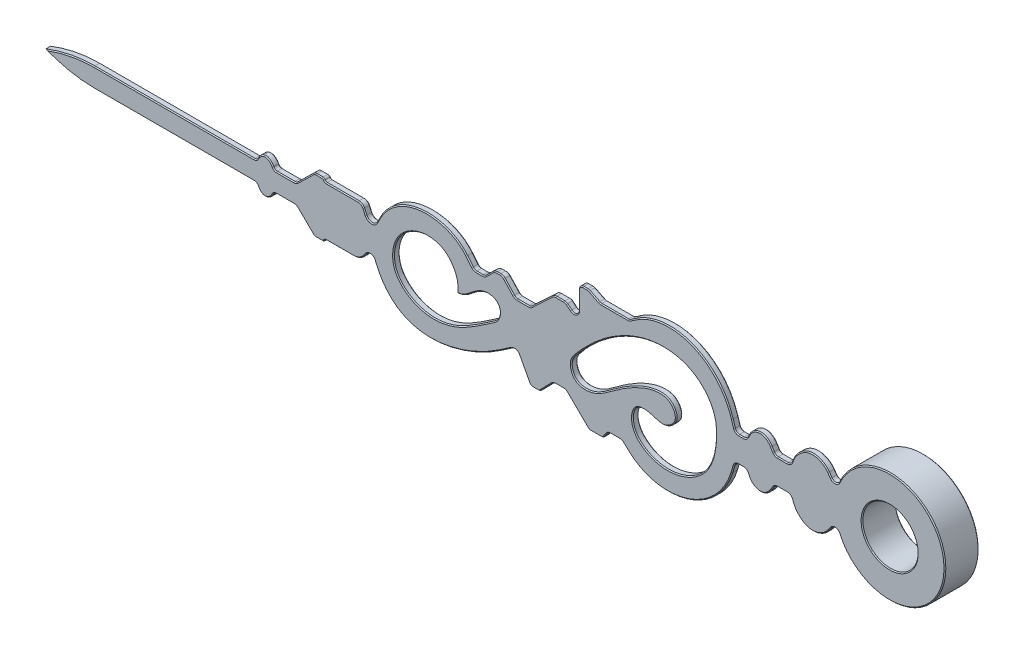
SolidWorks part; units mm, degrees
ref_plane "Спереди" through (0, 0, 0) normal (0, 0, 1) x (1, 0, 0)
ref_plane "Сверху" through (0, 0, 0) normal (0, 1, 0) x (1, 0, 0)
ref_plane "Справа" through (0, 0, 0) normal (1, 0, 0) x (0, 0, -1)
sketch "Эскиз1" plane through (0, 0, 0) normal (0, 0, 1) x (1, 0, 0)
  line L0 (-0.194, -1.2877) -> (0.0882, -1.076)
  line L1 (0.0882, -1.076) -> (0.2999, -0.7585)
  line L2 (0.2999, -0.7585) -> (0.441, -0.4057)
  line L3 (0.441, -0.4057) -> (0.5116, -0.1235)
  line L4 (0.5116, -0.1235) -> (0.4763, 0.194)
  line L5 (0.4763, 0.194) -> (0.3352, 0.5468)
  line L6 (0.3352, 0.5468) -> (0.0882, 0.7584)
  line L7 (0.0882, 0.7584) -> (-0.3351, 0.9701)
  line L8 (-0.3351, 0.9701) -> (-0.7584, 1.0407)
  line L9 (-0.7584, 1.0407) -> (-1.1465, 0.9701)
  line L10 (-1.1465, 0.9701) -> (-1.464, 0.8643)
  line L11 (-1.464, 0.8643) -> (-2.0284, 0.5468)
  line L12 (-2.0284, 0.5468) -> (-2.4871, 0.194)
  line L13 (-2.4871, 0.194) -> (-3.0515, -0.2293)
  line L14 (-3.0515, -0.2293) -> (-3.5454, -0.5116)
  line L15 (-3.5454, -0.5116) -> (-4.1098, -0.5821)
  line L16 (-4.1098, -0.5821) -> (-4.1098, 0.1587)
  line L17 (-4.1098, 0.1587) -> (-4.2862, 0.9348)
  line L18 (-4.2862, 0.9348) -> (-4.6037, 1.6757)
  line L19 (-4.6037, 1.6757) -> (-5.0976, 2.3107)
  line L20 (-5.0976, 2.3107) -> (-5.5209, 2.6634)
  line L21 (-5.5209, 2.6634) -> (-6.0148, 2.9457)
  line L22 (-6.0148, 2.9457) -> (-6.544, 3.0868)
  line L23 (-6.544, 3.0868) -> (-7.3554, 3.1573)
  line L24 (-7.3554, 3.1573) -> (-8.1668, 3.0515)
  line L25 (-8.1668, 3.0515) -> (-8.9429, 2.7693)
  line L26 (-8.9429, 2.7693) -> (-9.6132, 2.3459)
  line L27 (-9.6132, 2.3459) -> (-10.1776, 1.7815)
  line L28 (-10.1776, 1.7815) -> (-10.6362, 1.0759)
  line L29 (-10.6362, 1.0759) -> (-10.8832, 0.3351)
  line L30 (-10.8832, 0.3351) -> (-10.989, -0.5116)
  line L31 (-10.989, -0.5116) -> (-10.9184, -1.1113)
  line L32 (-10.9184, -1.1113) -> (-10.7773, -1.711)
  line L33 (-10.7773, -1.711) -> (-10.4951, -2.2402)
  line L34 (-10.4951, -2.2402) -> (-9.8954, -2.9457)
  line L35 (-9.8954, -2.9457) -> (-9.1898, -3.4749)
  line L36 (-9.1898, -3.4749) -> (-8.3784, -3.863)
  line L37 (-8.3784, -3.863) -> (-7.5318, -4.0746)
  line L38 (-7.5318, -4.0746) -> (-6.6851, -4.1804)
  line L39 (-6.6851, -4.1804) -> (-5.8384, -4.1452)
  line L40 (-5.8384, -4.1452) -> (-4.7448, -3.8982)
  line L41 (-4.7448, -3.8982) -> (-3.7218, -3.5102)
  line L42 (-3.7218, -3.5102) -> (-2.7693, -2.981)
  line L43 (-2.7693, -2.981) -> (-1.8521, -2.4166)
  line L44 (-1.8521, -2.4166) -> (-1.0054, -1.8521)
  line L45 (-1.0054, -1.8521) -> (-0.194, -1.2877)
  line L46 (23.9713, -0.0177) -> (23.936, 0.8643)
  line L47 (23.936, 0.8643) -> (23.7949, 1.7462)
  line L48 (23.7949, 1.7462) -> (23.5127, 2.5929)
  line L49 (23.5127, 2.5929) -> (23.0188, 3.369)
  line L50 (23.0188, 3.369) -> (22.3838, 4.0393)
  line L51 (22.3838, 4.0393) -> (21.6782, 4.5684)
  line L52 (21.6782, 4.5684) -> (20.761, 5.027)
  line L53 (20.761, 5.027) -> (19.8085, 5.3093)
  line L54 (19.8085, 5.3093) -> (18.8207, 5.4857)
  line L55 (18.8207, 5.4857) -> (17.8329, 5.4857)
  line L56 (17.8329, 5.4857) -> (16.5277, 5.3093)
  line L57 (16.5277, 5.3093) -> (15.2929, 4.9565)
  line L58 (15.2929, 4.9565) -> (14.0935, 4.4626)
  line L59 (14.0935, 4.4626) -> (12.8588, 3.7218)
  line L60 (12.8588, 3.7218) -> (11.6946, 2.9104)
  line L61 (11.6946, 2.9104) -> (10.601, 1.9579)
  line L62 (10.601, 1.9579) -> (9.2957, 0.6173)
  line L63 (9.2957, 0.6173) -> (9.0488, 0.3351)
  line L64 (9.0488, 0.3351) -> (8.8371, 0.0882)
  line L65 (8.8371, 0.0882) -> (8.5902, -0.2293)
  line L66 (8.5902, -0.2293) -> (8.3432, -0.7232)
  line L67 (8.3432, -0.7232) -> (8.2727, -1.1113)
  line L68 (8.2727, -1.1113) -> (8.3432, -1.5346)
  line L69 (8.3432, -1.5346) -> (8.4843, -1.9227)
  line L70 (8.4843, -1.9227) -> (8.7666, -2.2402)
  line L71 (8.7666, -2.2402) -> (9.1193, -2.4518)
  line L72 (9.1193, -2.4518) -> (9.5074, -2.5577)
  line L73 (9.5074, -2.5577) -> (10.1424, -2.593)
  line L74 (10.1424, -2.593) -> (10.7068, -2.4518)
  line L75 (10.7068, -2.4518) -> (11.1654, -2.2754)
  line L76 (11.1654, -2.2754) -> (11.5888, -2.0285)
  line L77 (11.5888, -2.0285) -> (11.9768, -1.7816)
  line L78 (11.9768, -1.7816) -> (12.3649, -1.4993)
  line L79 (12.3649, -1.4993) -> (13.2468, -0.8996)
  line L80 (13.2468, -0.8996) -> (14.0935, -0.2999)
  line L81 (14.0935, -0.2999) -> (14.9754, 0.2293)
  line L82 (14.9754, 0.2293) -> (15.9279, 0.6526)
  line L83 (15.9279, 0.6526) -> (16.951, 0.9701)
  line L84 (16.951, 0.9701) -> (17.7271, 1.1112)
  line L85 (17.7271, 1.1112) -> (18.4327, 1.0759)
  line L86 (18.4327, 1.0759) -> (18.8207, 0.9348)
  line L87 (18.8207, 0.9348) -> (19.1382, 0.6879)
  line L88 (19.1382, 0.6879) -> (19.4204, 0.3704)
  line L89 (19.4204, 0.3704) -> (19.5968, -0.1235)
  line L90 (19.5968, -0.1235) -> (19.6674, -0.6174)
  line L91 (19.6674, -0.6174) -> (19.5968, -1.0407)
  line L92 (19.5968, -1.0407) -> (19.3146, -1.3582)
  line L93 (19.3146, -1.3582) -> (18.8913, -1.6404)
  line L94 (18.8913, -1.6404) -> (18.3621, -1.7816)
  line L95 (18.3621, -1.7816) -> (18.0093, -1.8168)
  line L96 (18.0093, -1.8168) -> (17.6918, -1.7463)
  line L97 (17.6918, -1.7463) -> (17.3743, -1.6404)
  line L98 (17.3743, -1.6404) -> (17.0568, -1.5346)
  line L99 (17.0568, -1.5346) -> (16.6688, -1.4288)
  line L100 (16.6688, -1.4288) -> (16.2454, -1.3935)
  line L101 (16.2454, -1.3935) -> (15.8221, -1.4641)
  line L102 (15.8221, -1.4641) -> (15.3988, -1.6052)
  line L103 (15.3988, -1.6052) -> (15.046, -1.958)
  line L104 (15.046, -1.958) -> (14.9049, -2.4166)
  line L105 (14.9049, -2.4166) -> (14.8696, -2.8399)
  line L106 (14.8696, -2.8399) -> (14.9754, -3.2632)
  line L107 (14.9754, -3.2632) -> (15.2224, -3.8277)
  line L108 (15.2224, -3.8277) -> (15.5399, -4.3568)
  line L109 (15.5399, -4.3568) -> (15.9985, -4.8154)
  line L110 (15.9985, -4.8154) -> (16.5277, -5.1682)
  line L111 (16.5277, -5.1682) -> (17.0921, -5.4152)
  line L112 (17.0921, -5.4152) -> (17.6566, -5.5916)
  line L113 (17.6566, -5.5916) -> (18.2563, -5.6974)
  line L114 (18.2563, -5.6974) -> (19.2793, -5.6974)
  line L115 (19.2793, -5.6974) -> (20.3024, -5.521)
  line L116 (20.3024, -5.521) -> (21.2549, -5.133)
  line L117 (21.2549, -5.133) -> (22.1016, -4.5332)
  line L118 (22.1016, -4.5332) -> (22.8071, -3.8277)
  line L119 (22.8071, -3.8277) -> (23.3363, -2.9457)
  line L120 (23.3363, -2.9457) -> (23.6891, -2.0285)
  line L121 (23.6891, -2.0285) -> (23.9007, -1.0407)
  line L122 (23.9007, -1.0407) -> (23.9713, -0.0177)
  line L123 (10.0366, -6.1207) -> (10.0718, -6.156)
  line L124 (10.0718, -6.156) -> (10.1424, -6.1913)
  line L125 (10.1424, -6.1913) -> (10.1777, -6.2266)
  line L126 (10.1777, -6.2266) -> (10.2129, -6.2266)
  line L127 (10.2129, -6.2266) -> (10.2482, -6.2618)
  line L128 (10.2482, -6.2618) -> (10.3188, -6.2618)
  line L129 (10.3188, -6.2618) -> (10.3541, -6.2618)
  line L130 (10.3541, -6.2618) -> (10.3893, -6.2971)
  line L131 (7.8141, -3.9335) -> (10.0366, -6.1207)
  line L132 (7.4613, -3.7924) -> (7.5318, -3.7924)
  line L133 (7.5318, -3.7924) -> (7.5671, -3.7924)
  line L134 (7.5671, -3.7924) -> (7.6024, -3.8277)
  line L135 (7.6024, -3.8277) -> (7.6729, -3.8277)
  line L136 (7.6729, -3.8277) -> (7.7082, -3.863)
  line L137 (7.7082, -3.863) -> (7.7435, -3.863)
  line L138 (7.7435, -3.863) -> (7.7788, -3.8982)
  line L139 (7.7788, -3.8982) -> (7.8141, -3.9335)
  line L140 (6.5793, -3.7924) -> (7.4613, -3.7924)
  line L141 (6.2266, -3.9335) -> (6.2618, -3.8982)
  line L142 (6.2618, -3.8982) -> (6.2971, -3.863)
  line L143 (6.2971, -3.863) -> (6.3677, -3.863)
  line L144 (6.3677, -3.863) -> (6.4029, -3.8277)
  line L145 (6.4029, -3.8277) -> (6.4382, -3.8277)
  line L146 (6.4382, -3.8277) -> (6.4735, -3.7924)
  line L147 (6.4735, -3.7924) -> (6.5441, -3.7924)
  line L148 (6.5441, -3.7924) -> (6.5793, -3.7924)
  line L149 (4.9918, -5.2035) -> (6.2266, -3.9335)
  line L150 (4.6391, -5.3446) -> (4.6743, -5.3446)
  line L151 (4.6743, -5.3446) -> (4.7449, -5.3446)
  line L152 (4.7449, -5.3446) -> (4.7802, -5.3093)
  line L153 (4.7802, -5.3093) -> (4.8154, -5.3093)
  line L154 (4.8154, -5.3093) -> (4.886, -5.2741)
  line L155 (4.886, -5.2741) -> (4.9213, -5.2741)
  line L156 (4.9213, -5.2741) -> (4.9566, -5.2388)
  line L157 (4.9566, -5.2388) -> (4.9918, -5.2035)
  line L158 (4.1804, -5.3446) -> (4.6391, -5.3446)
  line L159 (3.7218, -5.0977) -> (3.7571, -5.133)
  line L160 (3.7571, -5.133) -> (3.8277, -5.2035)
  line L161 (3.8277, -5.2035) -> (3.8629, -5.2388)
  line L162 (3.8629, -5.2388) -> (3.9335, -5.2741)
  line L163 (3.9335, -5.2741) -> (3.9688, -5.3093)
  line L164 (3.9688, -5.3093) -> (4.0393, -5.3446)
  line L165 (4.0393, -5.3446) -> (4.1099, -5.3446)
  line L166 (4.1099, -5.3446) -> (4.1804, -5.3446)
  line L167 (2.5929, -2.981) -> (3.7218, -5.0977)
  line L168 (2.1696, -2.7341) -> (2.2402, -2.7341)
  line L169 (2.2402, -2.7341) -> (2.2754, -2.7341)
  line L170 (2.2754, -2.7341) -> (2.346, -2.7693)
  line L171 (2.346, -2.7693) -> (2.4166, -2.8046)
  line L172 (2.4166, -2.8046) -> (2.4518, -2.8399)
  line L173 (2.4518, -2.8399) -> (2.5224, -2.8752)
  line L174 (2.5224, -2.8752) -> (2.5577, -2.9457)
  line L175 (2.5577, -2.9457) -> (2.5929, -2.981)
  line L176 (2.0638, -2.7341) -> (2.1696, -2.7341)
  line L177 (1.7816, -2.8399) -> (1.8168, -2.8046)
  line L178 (1.8168, -2.8046) -> (1.8521, -2.7693)
  line L179 (1.8521, -2.7693) -> (1.8874, -2.7693)
  line L180 (1.8874, -2.7693) -> (1.9227, -2.7693)
  line L181 (1.9227, -2.7693) -> (1.9579, -2.7341)
  line L182 (1.9579, -2.7341) -> (1.9932, -2.7341)
  line L183 (1.9932, -2.7341) -> (2.0285, -2.7341)
  line L184 (2.0285, -2.7341) -> (2.0638, -2.7341)
  line L185 (-15.8221, -2.7341) -> (-15.2929, -2.7341)
  line L186 (-15.2929, -2.7341) -> (-14.8343, -2.6282)
  line L187 (-14.8343, -2.6282) -> (-14.4815, -2.4518)
  line L188 (-14.4815, -2.4518) -> (-14.2346, -2.2402)
  line L189 (-14.2346, -2.2402) -> (-14.0229, -1.958)
  line L190 (-14.0229, -1.958) -> (-13.8465, -1.7463)
  line L191 (-13.8465, -1.7463) -> (-13.5996, -1.6052)
  line L192 (-13.5996, -1.6052) -> (-13.4584, -1.6052)
  line L193 (-13.4584, -1.6052) -> (-13.3173, -1.6757)
  line L194 (-13.3173, -1.6757) -> (-13.1762, -1.7463)
  line L195 (-13.1762, -1.7463) -> (-13.1057, -1.8521)
  line L196 (-13.1057, -1.8521) -> (-13.0351, -2.0285)
  line L197 (-13.0351, -2.0285) -> (-12.9293, -2.2402)
  line L198 (-12.9293, -2.2402) -> (-12.5059, -3.0516)
  line L199 (-12.5059, -3.0516) -> (-11.9415, -3.8982)
  line L200 (-11.9415, -3.8982) -> (-11.2359, -4.6743)
  line L201 (-11.2359, -4.6743) -> (-10.4246, -5.3093)
  line L202 (-10.4246, -5.3093) -> (-9.5779, -5.8032)
  line L203 (-9.5779, -5.8032) -> (-8.6254, -6.1207)
  line L204 (-8.6254, -6.1207) -> (-7.6729, -6.2971)
  line L205 (-7.6729, -6.2971) -> (-6.544, -6.2971)
  line L206 (-6.544, -6.2971) -> (-5.3798, -6.1207)
  line L207 (-5.3798, -6.1207) -> (-4.2862, -5.8385)
  line L208 (-4.2862, -5.8385) -> (-3.1926, -5.4857)
  line L209 (-3.1926, -5.4857) -> (-2.099, -5.0624)
  line L210 (-2.099, -5.0624) -> (-0.7584, -4.4274)
  line L211 (-0.7584, -4.4274) -> (0.5468, -3.6866)
  line L212 (0.5468, -3.6866) -> (1.7816, -2.8399)
  line L213 (-18.3973, -2.7341) -> (-15.8221, -2.7341)
  line L214 (-18.4679, -2.8046) -> (-18.3973, -2.7341)
  line L215 (-18.8912, -3.0163) -> (-18.8207, -3.0163)
  line L216 (-18.8207, -3.0163) -> (-18.7501, -3.0163)
  line L217 (-18.7501, -3.0163) -> (-18.7148, -2.981)
  line L218 (-18.7148, -2.981) -> (-18.6443, -2.981)
  line L219 (-18.6443, -2.981) -> (-18.609, -2.9457)
  line L220 (-18.609, -2.9457) -> (-18.5384, -2.9104)
  line L221 (-18.5384, -2.9104) -> (-18.5032, -2.8752)
  line L222 (-18.5032, -2.8752) -> (-18.4679, -2.8046)
  line L223 (-19.3851, -3.0163) -> (-18.8912, -3.0163)
  line L224 (-19.7379, -2.8752) -> (-19.7026, -2.9104)
  line L225 (-19.7026, -2.9104) -> (-19.6673, -2.9457)
  line L226 (-19.6673, -2.9457) -> (-19.5968, -2.981)
  line L227 (-19.5968, -2.981) -> (-19.5615, -2.981)
  line L228 (-19.5615, -2.981) -> (-19.5262, -3.0163)
  line L229 (-19.5262, -3.0163) -> (-19.4909, -3.0163)
  line L230 (-19.4909, -3.0163) -> (-19.4204, -3.0163)
  line L231 (-19.4204, -3.0163) -> (-19.3851, -3.0163)
  line L232 (-21.4312, -1.2171) -> (-19.7379, -2.8752)
  line L233 (-21.784, -1.076) -> (-21.7487, -1.076)
  line L234 (-21.7487, -1.076) -> (-21.6782, -1.076)
  line L235 (-21.6782, -1.076) -> (-21.6429, -1.076)
  line L236 (-21.6429, -1.076) -> (-21.6076, -1.1113)
  line L237 (-21.6076, -1.1113) -> (-21.5723, -1.1113)
  line L238 (-21.5723, -1.1113) -> (-21.5018, -1.1466)
  line L239 (-21.5018, -1.1466) -> (-21.4665, -1.1818)
  line L240 (-21.4665, -1.1818) -> (-21.4312, -1.2171)
  line L241 (-23.6537, -1.076) -> (-21.784, -1.076)
  line L242 (-24.0771, -1.323) -> (-24.0418, -1.2524)
  line L243 (-24.0418, -1.2524) -> (-24.0065, -1.2171)
  line L244 (-24.0065, -1.2171) -> (-23.9712, -1.1818)
  line L245 (-23.9712, -1.1818) -> (-23.9007, -1.1466)
  line L246 (-23.9007, -1.1466) -> (-23.8301, -1.1113)
  line L247 (-23.8301, -1.1113) -> (-23.7948, -1.076)
  line L248 (-23.7948, -1.076) -> (-23.7243, -1.076)
  line L249 (-23.7243, -1.076) -> (-23.6537, -1.076)
  line L250 (-25.7351, -1.323) -> (-25.594, -1.5346)
  line L251 (-25.594, -1.5346) -> (-25.4176, -1.7463)
  line L252 (-25.4176, -1.7463) -> (-25.2412, -1.8521)
  line L253 (-25.2412, -1.8521) -> (-25.0296, -1.9227)
  line L254 (-25.0296, -1.9227) -> (-24.8179, -1.9227)
  line L255 (-24.8179, -1.9227) -> (-24.6062, -1.8521)
  line L256 (-24.6062, -1.8521) -> (-24.4298, -1.7463)
  line L257 (-24.4298, -1.7463) -> (-24.2534, -1.5346)
  line L258 (-24.2534, -1.5346) -> (-24.0771, -1.323)
  line L259 (-26.1937, -1.076) -> (-26.1232, -1.076)
  line L260 (-26.1232, -1.076) -> (-26.0526, -1.076)
  line L261 (-26.0526, -1.076) -> (-25.9821, -1.1113)
  line L262 (-25.9821, -1.1113) -> (-25.9468, -1.1466)
  line L263 (-25.9468, -1.1466) -> (-25.8762, -1.1818)
  line L264 (-25.8762, -1.1818) -> (-25.8409, -1.2171)
  line L265 (-25.8409, -1.2171) -> (-25.7704, -1.2524)
  line L266 (-25.7704, -1.2524) -> (-25.7351, -1.323)
  line L267 (-43.4798, -1.076) -> (-26.1937, -1.076)
  line L268 (-48.8068, -0.0177) -> (-48.1718, -0.2646)
  line L269 (-48.1718, -0.2646) -> (-47.5368, -0.4763)
  line L270 (-47.5368, -0.4763) -> (-46.8665, -0.6527)
  line L271 (-46.8665, -0.6527) -> (-46.1962, -0.7938)
  line L272 (-46.1962, -0.7938) -> (-45.5259, -0.9349)
  line L273 (-45.5259, -0.9349) -> (-44.8557, -1.0054)
  line L274 (-44.8557, -1.0054) -> (-44.1854, -1.0407)
  line L275 (-44.1854, -1.0407) -> (-43.4798, -1.076)
  line L276 (-43.4798, 1.0407) -> (-44.1854, 1.0054)
  line L277 (-44.1854, 1.0054) -> (-44.8557, 0.9701)
  line L278 (-44.8557, 0.9701) -> (-45.5259, 0.8996)
  line L279 (-45.5259, 0.8996) -> (-46.1962, 0.7584)
  line L280 (-46.1962, 0.7584) -> (-46.8665, 0.6173)
  line L281 (-46.8665, 0.6173) -> (-47.5368, 0.4409)
  line L282 (-47.5368, 0.4409) -> (-48.1718, 0.2293)
  line L283 (-48.1718, 0.2293) -> (-48.8068, -0.0177)
  line L284 (-26.1937, 1.0407) -> (-43.4798, 1.0407)
  line L285 (-25.7351, 1.2876) -> (-25.7704, 1.217)
  line L286 (-25.7704, 1.217) -> (-25.8409, 1.1818)
  line L287 (-25.8409, 1.1818) -> (-25.8762, 1.1465)
  line L288 (-25.8762, 1.1465) -> (-25.9468, 1.1112)
  line L289 (-25.9468, 1.1112) -> (-25.9821, 1.0759)
  line L290 (-25.9821, 1.0759) -> (-26.0526, 1.0407)
  line L291 (-26.0526, 1.0407) -> (-26.1232, 1.0407)
  line L292 (-26.1232, 1.0407) -> (-26.1937, 1.0407)
  line L293 (-24.0771, 1.2876) -> (-24.2534, 1.5346)
  line L294 (-24.2534, 1.5346) -> (-24.4298, 1.7109)
  line L295 (-24.4298, 1.7109) -> (-24.6062, 1.8168)
  line L296 (-24.6062, 1.8168) -> (-24.8179, 1.8873)
  line L297 (-24.8179, 1.8873) -> (-25.0296, 1.8873)
  line L298 (-25.0296, 1.8873) -> (-25.2412, 1.8168)
  line L299 (-25.2412, 1.8168) -> (-25.4176, 1.7109)
  line L300 (-25.4176, 1.7109) -> (-25.594, 1.5346)
  line L301 (-25.594, 1.5346) -> (-25.7351, 1.2876)
  line L302 (-23.6537, 1.0407) -> (-23.7243, 1.0407)
  line L303 (-23.7243, 1.0407) -> (-23.7948, 1.0407)
  line L304 (-23.7948, 1.0407) -> (-23.8301, 1.0759)
  line L305 (-23.8301, 1.0759) -> (-23.9007, 1.1112)
  line L306 (-23.9007, 1.1112) -> (-23.9712, 1.1465)
  line L307 (-23.9712, 1.1465) -> (-24.0065, 1.1818)
  line L308 (-24.0065, 1.1818) -> (-24.0418, 1.217)
  line L309 (-24.0418, 1.217) -> (-24.0771, 1.2876)
  line L310 (-21.784, 1.0407) -> (-23.6537, 1.0407)
  line L311 (-21.4312, 1.1818) -> (-21.4665, 1.1465)
  line L312 (-21.4665, 1.1465) -> (-21.5018, 1.1112)
  line L313 (-21.5018, 1.1112) -> (-21.5723, 1.0759)
  line L314 (-21.5723, 1.0759) -> (-21.6076, 1.0759)
  line L315 (-21.6076, 1.0759) -> (-21.6429, 1.0407)
  line L316 (-21.6429, 1.0407) -> (-21.6782, 1.0407)
  line L317 (-21.6782, 1.0407) -> (-21.7487, 1.0407)
  line L318 (-21.7487, 1.0407) -> (-21.784, 1.0407)
  line L319 (-19.7379, 2.8398) -> (-21.4312, 1.1818)
  line L320 (-19.3851, 2.9809) -> (-19.4204, 2.9809)
  line L321 (-19.4204, 2.9809) -> (-19.4909, 2.9809)
  line L322 (-19.4909, 2.9809) -> (-19.5262, 2.9809)
  line L323 (-19.5262, 2.9809) -> (-19.5615, 2.9457)
  line L324 (-19.5615, 2.9457) -> (-19.5968, 2.9457)
  line L325 (-19.5968, 2.9457) -> (-19.6673, 2.9104)
  line L326 (-19.6673, 2.9104) -> (-19.7026, 2.8751)
  line L327 (-19.7026, 2.8751) -> (-19.7379, 2.8398)
  line L328 (-18.8912, 2.9809) -> (-19.3851, 2.9809)
  line L329 (-18.4679, 2.7693) -> (-18.5032, 2.8398)
  line L330 (-18.5032, 2.8398) -> (-18.5384, 2.8751)
  line L331 (-18.5384, 2.8751) -> (-18.609, 2.9104)
  line L332 (-18.609, 2.9104) -> (-18.6443, 2.9457)
  line L333 (-18.6443, 2.9457) -> (-18.7148, 2.9457)
  line L334 (-18.7148, 2.9457) -> (-18.7501, 2.9809)
  line L335 (-18.7501, 2.9809) -> (-18.8207, 2.9809)
  line L336 (-18.8207, 2.9809) -> (-18.8912, 2.9809)
  line L337 (-18.3973, 2.6987) -> (-18.4679, 2.7693)
  line L338 (-15.3634, 2.6987) -> (-18.3973, 2.6987)
  line L339 (-2.4518, 2.6987) -> (-3.0515, 3.4396)
  line L340 (-3.0515, 3.4396) -> (-3.7923, 4.0746)
  line L341 (-3.7923, 4.0746) -> (-4.5684, 4.6037)
  line L342 (-4.5684, 4.6037) -> (-5.4504, 4.9918)
  line L343 (-5.4504, 4.9918) -> (-6.4029, 5.2387)
  line L344 (-6.4029, 5.2387) -> (-7.4259, 5.3798)
  line L345 (-7.4259, 5.3798) -> (-8.4137, 5.3093)
  line L346 (-8.4137, 5.3093) -> (-9.3662, 5.0623)
  line L347 (-9.3662, 5.0623) -> (-10.2834, 4.639)
  line L348 (-10.2834, 4.639) -> (-11.0948, 4.0393)
  line L349 (-11.0948, 4.0393) -> (-11.8357, 3.3337)
  line L350 (-11.8357, 3.3337) -> (-12.2237, 2.8398)
  line L351 (-12.2237, 2.8398) -> (-12.5412, 2.2754)
  line L352 (-12.5412, 2.2754) -> (-12.7529, 1.852)
  line L353 (-12.7529, 1.852) -> (-13.1057, 1.464)
  line L354 (-13.1057, 1.464) -> (-13.2821, 1.3934)
  line L355 (-13.2821, 1.3934) -> (-13.4584, 1.3582)
  line L356 (-13.4584, 1.3582) -> (-13.6348, 1.3934)
  line L357 (-13.6348, 1.3934) -> (-13.7759, 1.5346)
  line L358 (-13.7759, 1.5346) -> (-13.9876, 1.7815)
  line L359 (-13.9876, 1.7815) -> (-14.1287, 2.099)
  line L360 (-14.1287, 2.099) -> (-14.2698, 2.3812)
  line L361 (-14.2698, 2.3812) -> (-14.4109, 2.5576)
  line L362 (-14.4109, 2.5576) -> (-14.6226, 2.6634)
  line L363 (-14.6226, 2.6634) -> (-14.9401, 2.734)
  line L364 (-14.9401, 2.734) -> (-15.3634, 2.6987)
  line L365 (-2.0284, 2.487) -> (-2.099, 2.487)
  line L366 (-2.099, 2.487) -> (-2.1696, 2.5223)
  line L367 (-2.1696, 2.5223) -> (-2.2048, 2.5223)
  line L368 (-2.2048, 2.5223) -> (-2.2754, 2.5576)
  line L369 (-2.2754, 2.5576) -> (-2.3107, 2.5929)
  line L370 (-2.3107, 2.5929) -> (-2.3812, 2.6282)
  line L371 (-2.3812, 2.6282) -> (-2.4165, 2.6634)
  line L372 (-2.4165, 2.6634) -> (-2.4518, 2.6987)
  line L373 (-1.3582, 2.487) -> (-2.0284, 2.487)
  line L374 (-1.0054, 2.6282) -> (-1.0407, 2.5929)
  line L375 (-1.0407, 2.5929) -> (-1.0759, 2.5929)
  line L376 (-1.0759, 2.5929) -> (-1.1112, 2.5576)
  line L377 (-1.1112, 2.5576) -> (-1.1818, 2.5223)
  line L378 (-1.1818, 2.5223) -> (-1.2171, 2.5223)
  line L379 (-1.2171, 2.5223) -> (-1.2523, 2.5223)
  line L380 (-1.2523, 2.5223) -> (-1.2876, 2.487)
  line L381 (-1.2876, 2.487) -> (-1.3582, 2.487)
  line L382 (-0.194, 3.4043) -> (-1.0054, 2.6282)
  line L383 (0.1588, 3.5454) -> (0.0882, 3.5101)
  line L384 (0.0882, 3.5101) -> (0.0529, 3.5101)
  line L385 (0.0529, 3.5101) -> (0.0177, 3.5101)
  line L386 (0.0177, 3.5101) -> (-0.0529, 3.5101)
  line L387 (-0.0529, 3.5101) -> (-0.0882, 3.4748)
  line L388 (-0.0882, 3.4748) -> (-0.1234, 3.4396)
  line L389 (-0.1234, 3.4396) -> (-0.1587, 3.4396)
  line L390 (-0.1587, 3.4396) -> (-0.194, 3.4043)
  line L391 (0.6527, 3.5454) -> (0.1588, 3.5454)
  line L392 (1.0054, 3.369) -> (0.9702, 3.4043)
  line L393 (0.9702, 3.4043) -> (0.9349, 3.4396)
  line L394 (0.9349, 3.4396) -> (0.8996, 3.4748)
  line L395 (0.8996, 3.4748) -> (0.8291, 3.4748)
  line L396 (0.8291, 3.4748) -> (0.7938, 3.5101)
  line L397 (0.7938, 3.5101) -> (0.7585, 3.5101)
  line L398 (0.7585, 3.5101) -> (0.6879, 3.5101)
  line L399 (0.6879, 3.5101) -> (0.6527, 3.5454)
  line L400 (2.0285, 2.2754) -> (1.0054, 3.369)
  line L401 (2.4166, 2.099) -> (2.346, 2.1343)
  line L402 (2.346, 2.1343) -> (2.3107, 2.1343)
  line L403 (2.3107, 2.1343) -> (2.2402, 2.1343)
  line L404 (2.2402, 2.1343) -> (2.2049, 2.1696)
  line L405 (2.2049, 2.1696) -> (2.1696, 2.1696)
  line L406 (2.1696, 2.1696) -> (2.1343, 2.2048)
  line L407 (2.1343, 2.2048) -> (2.0638, 2.2401)
  line L408 (2.0638, 2.2401) -> (2.0285, 2.2754)
  line L409 (3.6866, 2.099) -> (2.4166, 2.099)
  line L410 (4.0041, 2.2401) -> (3.9688, 2.2048)
  line L411 (3.9688, 2.2048) -> (3.9335, 2.2048)
  line L412 (3.9335, 2.2048) -> (3.8982, 2.1696)
  line L413 (3.8982, 2.1696) -> (3.8629, 2.1343)
  line L414 (3.8629, 2.1343) -> (3.8277, 2.1343)
  line L415 (3.8277, 2.1343) -> (3.7571, 2.1343)
  line L416 (3.7571, 2.1343) -> (3.7218, 2.1343)
  line L417 (3.7218, 2.1343) -> (3.6866, 2.099)
  line L418 (6.2266, 4.3215) -> (4.0041, 2.2401)
  line L419 (6.5793, 4.4626) -> (6.5441, 4.4626)
  line L420 (6.5441, 4.4626) -> (6.4735, 4.4626)
  line L421 (6.4735, 4.4626) -> (6.4382, 4.4626)
  line L422 (6.4382, 4.4626) -> (6.4029, 4.4273)
  line L423 (6.4029, 4.4273) -> (6.3677, 4.4273)
  line L424 (6.3677, 4.4273) -> (6.2971, 4.392)
  line L425 (6.2971, 4.392) -> (6.2618, 4.3568)
  line L426 (6.2618, 4.3568) -> (6.2266, 4.3215)
  line L427 (7.4966, 4.4626) -> (6.5793, 4.4626)
  line L428 (7.8141, 4.3568) -> (7.7788, 4.392)
  line L429 (7.7788, 4.392) -> (7.7435, 4.392)
  line L430 (7.7435, 4.392) -> (7.7082, 4.4273)
  line L431 (7.7082, 4.4273) -> (7.6729, 4.4273)
  line L432 (7.6729, 4.4273) -> (7.6377, 4.4626)
  line L433 (7.6377, 4.4626) -> (7.5671, 4.4626)
  line L434 (7.5671, 4.4626) -> (7.5318, 4.4626)
  line L435 (7.5318, 4.4626) -> (7.4966, 4.4626)
  line L436 (8.2374, 4.004) -> (7.8141, 4.3568)
  line L437 (8.5549, 3.8629) -> (8.5196, 3.8629)
  line L438 (8.5196, 3.8629) -> (8.4491, 3.8629)
  line L439 (8.4491, 3.8629) -> (8.4138, 3.8982)
  line L440 (8.4138, 3.8982) -> (8.3785, 3.8982)
  line L441 (8.3785, 3.8982) -> (8.3432, 3.9334)
  line L442 (8.3432, 3.9334) -> (8.3079, 3.9334)
  line L443 (8.3079, 3.9334) -> (8.2727, 3.9687)
  line L444 (8.2727, 3.9687) -> (8.2374, 4.004)
  line L445 (8.5902, 3.8629) -> (8.5549, 3.8629)
  line L446 (9.0841, 4.3568) -> (9.0841, 4.2862)
  line L447 (9.0841, 4.2862) -> (9.0488, 4.1804)
  line L448 (9.0488, 4.1804) -> (8.9782, 4.1098)
  line L449 (8.9782, 4.1098) -> (8.9429, 4.004)
  line L450 (8.9429, 4.004) -> (8.8724, 3.9687)
  line L451 (8.8724, 3.9687) -> (8.7666, 3.8982)
  line L452 (8.7666, 3.8982) -> (8.6607, 3.8629)
  line L453 (8.6607, 3.8629) -> (8.5902, 3.8629)
  line L454 (9.0841, 6.3323) -> (9.0841, 4.3568)
  line L455 (9.5779, 6.8615) -> (9.4721, 6.8262)
  line L456 (9.4721, 6.8262) -> (9.4016, 6.7909)
  line L457 (9.4016, 6.7909) -> (9.2957, 6.7557)
  line L458 (9.2957, 6.7557) -> (9.2252, 6.6851)
  line L459 (9.2252, 6.6851) -> (9.1546, 6.6146)
  line L460 (9.1546, 6.6146) -> (9.1193, 6.544)
  line L461 (9.1193, 6.544) -> (9.0841, 6.4382)
  line L462 (9.0841, 6.4382) -> (9.0841, 6.3323)
  line L463 (10.0718, 6.8615) -> (9.5779, 6.8615)
  line L464 (10.2835, 6.7909) -> (10.2482, 6.7909)
  line L465 (10.2482, 6.7909) -> (10.2129, 6.8262)
  line L466 (10.2129, 6.8262) -> (10.1777, 6.8262)
  line L467 (10.1777, 6.8262) -> (10.1424, 6.8262)
  line L468 (10.1424, 6.8262) -> (10.1071, 6.8262)
  line L469 (10.1071, 6.8262) -> (10.1071, 6.8615)
  line L470 (10.1071, 6.8615) -> (10.0718, 6.8615)
  line L471 (11.3418, 6.2618) -> (10.2835, 6.7909)
  line L472 (11.5888, 6.2265) -> (11.5535, 6.2265)
  line L473 (11.5535, 6.2265) -> (11.5182, 6.2265)
  line L474 (11.5182, 6.2265) -> (11.4829, 6.2265)
  line L475 (11.4829, 6.2265) -> (11.4477, 6.2265)
  line L476 (11.4477, 6.2265) -> (11.4477, 6.2618)
  line L477 (11.4477, 6.2618) -> (11.4124, 6.2618)
  line L478 (11.4124, 6.2618) -> (11.3771, 6.2618)
  line L479 (11.3771, 6.2618) -> (11.3418, 6.2618)
  line L480 (14.411, 6.2265) -> (11.5888, 6.2265)
  line L481 (14.7285, 6.3323) -> (14.6932, 6.297)
  line L482 (14.6932, 6.297) -> (14.6579, 6.297)
  line L483 (14.6579, 6.297) -> (14.6227, 6.2618)
  line L484 (14.6227, 6.2618) -> (14.5521, 6.2618)
  line L485 (14.5521, 6.2618) -> (14.5168, 6.2265)
  line L486 (14.5168, 6.2265) -> (14.4816, 6.2265)
  line L487 (14.4816, 6.2265) -> (14.4463, 6.2265)
  line L488 (14.4463, 6.2265) -> (14.411, 6.2265)
  line L489 (25.9821, 1.8168) -> (25.7704, 2.487)
  line L490 (25.7704, 2.487) -> (25.5235, 3.1926)
  line L491 (25.5235, 3.1926) -> (25.2413, 3.8276)
  line L492 (25.2413, 3.8276) -> (24.8532, 4.4626)
  line L493 (24.8532, 4.4626) -> (24.4652, 5.027)
  line L494 (24.4652, 5.027) -> (24.0066, 5.5562)
  line L495 (24.0066, 5.5562) -> (23.5127, 6.0501)
  line L496 (23.5127, 6.0501) -> (22.9482, 6.4734)
  line L497 (22.9482, 6.4734) -> (22.3838, 6.8615)
  line L498 (22.3838, 6.8615) -> (21.7841, 7.179)
  line L499 (21.7841, 7.179) -> (21.1491, 7.4259)
  line L500 (21.1491, 7.4259) -> (20.4788, 7.6376)
  line L501 (20.4788, 7.6376) -> (19.8085, 7.7434)
  line L502 (19.8085, 7.7434) -> (19.1382, 7.814)
  line L503 (19.1382, 7.814) -> (18.4679, 7.7787)
  line L504 (18.4679, 7.7787) -> (17.7977, 7.7082)
  line L505 (17.7977, 7.7082) -> (17.1274, 7.567)
  line L506 (17.1274, 7.567) -> (16.4924, 7.3554)
  line L507 (16.4924, 7.3554) -> (15.8927, 7.0732)
  line L508 (15.8927, 7.0732) -> (15.2929, 6.7204)
  line L509 (15.2929, 6.7204) -> (14.7285, 6.3323)
  line L510 (26.4407, 1.3934) -> (26.3702, 1.4287)
  line L511 (26.3702, 1.4287) -> (26.2996, 1.4287)
  line L512 (26.2996, 1.4287) -> (26.1938, 1.464)
  line L513 (26.1938, 1.464) -> (26.1585, 1.5346)
  line L514 (26.1585, 1.5346) -> (26.0879, 1.5698)
  line L515 (26.0879, 1.5698) -> (26.0174, 1.6404)
  line L516 (26.0174, 1.6404) -> (25.9821, 1.7109)
  line L517 (25.9821, 1.7109) -> (25.9821, 1.8168)
  line L518 (26.9699, 1.3934) -> (26.4407, 1.3934)
  line L519 (27.4285, 1.6757) -> (27.3932, 1.6404)
  line L520 (27.3932, 1.6404) -> (27.3579, 1.5698)
  line L521 (27.3579, 1.5698) -> (27.2874, 1.5346)
  line L522 (27.2874, 1.5346) -> (27.2521, 1.4993)
  line L523 (27.2521, 1.4993) -> (27.1816, 1.464)
  line L524 (27.1816, 1.464) -> (27.111, 1.4287)
  line L525 (27.111, 1.4287) -> (27.0404, 1.4287)
  line L526 (27.0404, 1.4287) -> (26.9699, 1.3934)
  line L527 (30.2154, 1.6757) -> (30.0038, 2.0284)
  line L528 (30.0038, 2.0284) -> (29.7921, 2.3107)
  line L529 (29.7921, 2.3107) -> (29.5452, 2.5223)
  line L530 (29.5452, 2.5223) -> (29.2629, 2.6987)
  line L531 (29.2629, 2.6987) -> (28.9807, 2.7693)
  line L532 (28.9807, 2.7693) -> (28.6632, 2.7693)
  line L533 (28.6632, 2.7693) -> (28.381, 2.6987)
  line L534 (28.381, 2.6987) -> (28.0988, 2.5223)
  line L535 (28.0988, 2.5223) -> (27.8518, 2.3107)
  line L536 (27.8518, 2.3107) -> (27.6049, 2.0284)
  line L537 (27.6049, 2.0284) -> (27.4285, 1.6757)
  line L538 (30.6741, 1.3934) -> (30.6035, 1.4287)
  line L539 (30.6035, 1.4287) -> (30.5329, 1.4287)
  line L540 (30.5329, 1.4287) -> (30.4624, 1.464)
  line L541 (30.4624, 1.464) -> (30.3918, 1.4993)
  line L542 (30.3918, 1.4993) -> (30.3566, 1.5346)
  line L543 (30.3566, 1.5346) -> (30.286, 1.5698)
  line L544 (30.286, 1.5698) -> (30.2507, 1.6404)
  line L545 (30.2507, 1.6404) -> (30.2154, 1.6757)
  line L546 (31.7324, 1.3934) -> (30.6741, 1.3934)
  line L547 (32.2263, 1.7462) -> (32.191, 1.6757)
  line L548 (32.191, 1.6757) -> (32.1204, 1.6051)
  line L549 (32.1204, 1.6051) -> (32.0852, 1.5346)
  line L550 (32.0852, 1.5346) -> (32.0146, 1.4993)
  line L551 (32.0146, 1.4993) -> (31.9441, 1.464)
  line L552 (31.9441, 1.464) -> (31.8735, 1.4287)
  line L553 (31.8735, 1.4287) -> (31.8029, 1.4287)
  line L554 (31.8029, 1.4287) -> (31.7324, 1.3934)
  line L555 (36.4596, 2.3812) -> (36.2127, 2.734)
  line L556 (36.2127, 2.734) -> (35.9304, 3.0515)
  line L557 (35.9304, 3.0515) -> (35.6129, 3.2984)
  line L558 (35.6129, 3.2984) -> (35.2954, 3.4748)
  line L559 (35.2954, 3.4748) -> (34.9427, 3.5807)
  line L560 (34.9427, 3.5807) -> (34.5899, 3.6512)
  line L561 (34.5899, 3.6512) -> (34.2371, 3.6159)
  line L562 (34.2371, 3.6159) -> (33.8491, 3.5454)
  line L563 (33.8491, 3.5454) -> (33.5316, 3.369)
  line L564 (33.5316, 3.369) -> (33.2141, 3.1573)
  line L565 (33.2141, 3.1573) -> (32.8966, 2.8751)
  line L566 (32.8966, 2.8751) -> (32.6496, 2.5576)
  line L567 (32.6496, 2.5576) -> (32.4027, 2.1696)
  line L568 (32.4027, 2.1696) -> (32.2263, 1.7462)
  line L569 (36.4596, 2.3812) -> (36.5654, 2.2754)
  line L570 (36.5654, 2.2754) -> (36.6713, 2.2048)
  line L571 (36.6713, 2.2048) -> (36.8124, 2.1696)
  line L572 (36.8124, 2.1696) -> (36.9182, 2.1343)
  line L573 (36.9182, 2.1343) -> (37.0593, 2.1696)
  line L574 (37.0593, 2.1696) -> (37.2004, 2.2401)
  line L575 (37.2004, 2.2401) -> (37.271, 2.3459)
  line L576 (37.271, 2.3459) -> (37.3416, 2.4518)
  line L577 (37.3416, 2.4518) -> (37.6591, 3.0162)
  line L578 (37.6591, 3.0162) -> (38.0118, 3.5454)
  line L579 (38.0118, 3.5454) -> (38.3999, 4.0393)
  line L580 (38.3999, 4.0393) -> (38.8585, 4.4979)
  line L581 (38.8585, 4.4979) -> (39.3524, 4.8859)
  line L582 (39.3524, 4.8859) -> (39.9168, 5.2387)
  line L583 (39.9168, 5.2387) -> (40.4813, 5.5209)
  line L584 (40.4813, 5.5209) -> (41.081, 5.7326)
  line L585 (41.081, 5.7326) -> (41.716, 5.8737)
  line L586 (41.716, 5.8737) -> (42.351, 5.9796)
  line L587 (42.351, 5.9796) -> (42.986, 5.9796)
  line L588 (42.986, 5.9796) -> (43.621, 5.9443)
  line L589 (43.621, 5.9443) -> (44.256, 5.8032)
  line L590 (44.256, 5.8032) -> (44.8557, 5.6268)
  line L591 (44.8557, 5.6268) -> (45.4554, 5.3798)
  line L592 (45.4554, 5.3798) -> (46.0199, 5.0623)
  line L593 (46.0199, 5.0623) -> (46.5138, 4.7096)
  line L594 (46.5138, 4.7096) -> (47.0077, 4.2862)
  line L595 (47.0077, 4.2862) -> (47.431, 3.8276)
  line L596 (47.431, 3.8276) -> (47.8191, 3.2984)
  line L597 (47.8191, 3.2984) -> (48.1366, 2.7693)
  line L598 (48.1366, 2.7693) -> (48.4188, 2.1696)
  line L599 (48.4188, 2.1696) -> (48.6304, 1.5698)
  line L600 (48.6304, 1.5698) -> (48.7363, 0.9348)
  line L601 (48.7363, 0.9348) -> (48.8068, 0.2998)
  line L602 (48.8068, 0.2998) -> (48.8068, -0.3352)
  line L603 (48.8068, -0.3352) -> (48.7363, -0.9702)
  line L604 (48.7363, -0.9702) -> (48.6304, -1.6052)
  line L605 (48.6304, -1.6052) -> (48.4188, -2.2049)
  line L606 (48.4188, -2.2049) -> (48.1366, -2.7693)
  line L607 (48.1366, -2.7693) -> (47.8191, -3.3338)
  line L608 (47.8191, -3.3338) -> (47.431, -3.863)
  line L609 (47.431, -3.863) -> (47.0077, -4.3216)
  line L610 (47.0077, -4.3216) -> (46.5138, -4.7449)
  line L611 (46.5138, -4.7449) -> (46.0199, -5.0977)
  line L612 (46.0199, -5.0977) -> (45.4554, -5.4152)
  line L613 (45.4554, -5.4152) -> (44.8557, -5.6621)
  line L614 (44.8557, -5.6621) -> (44.256, -5.8385)
  line L615 (44.256, -5.8385) -> (43.621, -5.9796)
  line L616 (43.621, -5.9796) -> (42.986, -6.0149)
  line L617 (42.986, -6.0149) -> (42.351, -6.0149)
  line L618 (42.351, -6.0149) -> (41.716, -5.9091)
  line L619 (41.716, -5.9091) -> (41.081, -5.768)
  line L620 (41.081, -5.768) -> (40.4813, -5.5563)
  line L621 (40.4813, -5.5563) -> (39.9168, -5.2741)
  line L622 (39.9168, -5.2741) -> (39.3524, -4.9213)
  line L623 (39.3524, -4.9213) -> (38.8585, -4.5332)
  line L624 (38.8585, -4.5332) -> (38.3999, -4.0746)
  line L625 (38.3999, -4.0746) -> (38.0118, -3.5807)
  line L626 (38.0118, -3.5807) -> (37.6591, -3.0516)
  line L627 (37.6591, -3.0516) -> (37.3416, -2.4871)
  line L628 (37.3416, -2.4871) -> (37.271, -2.3813)
  line L629 (37.271, -2.3813) -> (37.2004, -2.2754)
  line L630 (37.2004, -2.2754) -> (37.0593, -2.2049)
  line L631 (37.0593, -2.2049) -> (36.9182, -2.1696)
  line L632 (36.9182, -2.1696) -> (36.8124, -2.2049)
  line L633 (36.8124, -2.2049) -> (36.6713, -2.2402)
  line L634 (36.6713, -2.2402) -> (36.5654, -2.3107)
  line L635 (36.5654, -2.3107) -> (36.4596, -2.4166)
  line L636 (32.2263, -1.7816) -> (32.4027, -2.2049)
  line L637 (32.4027, -2.2049) -> (32.6496, -2.5577)
  line L638 (32.6496, -2.5577) -> (32.8966, -2.9104)
  line L639 (32.8966, -2.9104) -> (33.2141, -3.1927)
  line L640 (33.2141, -3.1927) -> (33.5316, -3.4043)
  line L641 (33.5316, -3.4043) -> (33.8491, -3.5807)
  line L642 (33.8491, -3.5807) -> (34.2371, -3.6513)
  line L643 (34.2371, -3.6513) -> (34.5899, -3.6866)
  line L644 (34.5899, -3.6866) -> (34.9427, -3.616)
  line L645 (34.9427, -3.616) -> (35.2954, -3.5102)
  line L646 (35.2954, -3.5102) -> (35.6129, -3.3338)
  line L647 (35.6129, -3.3338) -> (35.9304, -3.0868)
  line L648 (35.9304, -3.0868) -> (36.2127, -2.7693)
  line L649 (36.2127, -2.7693) -> (36.4596, -2.4166)
  line L650 (31.7324, -1.4288) -> (31.8029, -1.4641)
  line L651 (31.8029, -1.4641) -> (31.8735, -1.4641)
  line L652 (31.8735, -1.4641) -> (31.9441, -1.4993)
  line L653 (31.9441, -1.4993) -> (32.0146, -1.5346)
  line L654 (32.0146, -1.5346) -> (32.0852, -1.5699)
  line L655 (32.0852, -1.5699) -> (32.1204, -1.6404)
  line L656 (32.1204, -1.6404) -> (32.191, -1.711)
  line L657 (32.191, -1.711) -> (32.2263, -1.7816)
  line L658 (30.6741, -1.4288) -> (31.7324, -1.4288)
  line L659 (30.2154, -1.711) -> (30.2507, -1.6757)
  line L660 (30.2507, -1.6757) -> (30.286, -1.6052)
  line L661 (30.286, -1.6052) -> (30.3566, -1.5699)
  line L662 (30.3566, -1.5699) -> (30.3918, -1.5346)
  line L663 (30.3918, -1.5346) -> (30.4624, -1.4993)
  line L664 (30.4624, -1.4993) -> (30.5329, -1.4641)
  line L665 (30.5329, -1.4641) -> (30.6035, -1.4641)
  line L666 (30.6035, -1.4641) -> (30.6741, -1.4288)
  line L667 (27.4285, -1.711) -> (27.6049, -2.0638)
  line L668 (27.6049, -2.0638) -> (27.8518, -2.346)
  line L669 (27.8518, -2.346) -> (28.0988, -2.5577)
  line L670 (28.0988, -2.5577) -> (28.381, -2.7341)
  line L671 (28.381, -2.7341) -> (28.6632, -2.8046)
  line L672 (28.6632, -2.8046) -> (28.9807, -2.8046)
  line L673 (28.9807, -2.8046) -> (29.2629, -2.7341)
  line L674 (29.2629, -2.7341) -> (29.5452, -2.5577)
  line L675 (29.5452, -2.5577) -> (29.7921, -2.346)
  line L676 (29.7921, -2.346) -> (30.0038, -2.0638)
  line L677 (30.0038, -2.0638) -> (30.2154, -1.711)
  line L678 (26.9699, -1.4288) -> (27.0404, -1.4641)
  line L679 (27.0404, -1.4641) -> (27.111, -1.4641)
  line L680 (27.111, -1.4641) -> (27.1816, -1.4993)
  line L681 (27.1816, -1.4993) -> (27.2521, -1.5346)
  line L682 (27.2521, -1.5346) -> (27.2874, -1.5699)
  line L683 (27.2874, -1.5699) -> (27.3579, -1.6052)
  line L684 (27.3579, -1.6052) -> (27.3932, -1.6757)
  line L685 (27.3932, -1.6757) -> (27.4285, -1.711)
  line L686 (26.4407, -1.4288) -> (26.9699, -1.4288)
  line L687 (25.9468, -1.8521) -> (25.9468, -1.7463)
  line L688 (25.9468, -1.7463) -> (26.0174, -1.6757)
  line L689 (26.0174, -1.6757) -> (26.0527, -1.6052)
  line L690 (26.0527, -1.6052) -> (26.1232, -1.5699)
  line L691 (26.1232, -1.5699) -> (26.1938, -1.4993)
  line L692 (26.1938, -1.4993) -> (26.2643, -1.4641)
  line L693 (26.2643, -1.4641) -> (26.3349, -1.4641)
  line L694 (26.3349, -1.4641) -> (26.4407, -1.4288)
  line L695 (13.9524, -5.6621) -> (14.4816, -6.156)
  line L696 (14.4816, -6.156) -> (15.046, -6.5793)
  line L697 (15.046, -6.5793) -> (15.6457, -6.9321)
  line L698 (15.6457, -6.9321) -> (16.2807, -7.2496)
  line L699 (16.2807, -7.2496) -> (16.9157, -7.4966)
  line L700 (16.9157, -7.4966) -> (17.586, -7.673)
  line L701 (17.586, -7.673) -> (18.2563, -7.7788)
  line L702 (18.2563, -7.7788) -> (18.9266, -7.8141)
  line L703 (18.9266, -7.8141) -> (19.6321, -7.7788)
  line L704 (19.6321, -7.7788) -> (20.3024, -7.673)
  line L705 (20.3024, -7.673) -> (20.9727, -7.4966)
  line L706 (20.9727, -7.4966) -> (21.6077, -7.2496)
  line L707 (21.6077, -7.2496) -> (22.2427, -6.9321)
  line L708 (22.2427, -6.9321) -> (22.8424, -6.5793)
  line L709 (22.8424, -6.5793) -> (23.4068, -6.156)
  line L710 (23.4068, -6.156) -> (23.9007, -5.6621)
  line L711 (23.9007, -5.6621) -> (24.3946, -5.0977)
  line L712 (24.3946, -5.0977) -> (24.8179, -4.5332)
  line L713 (24.8179, -4.5332) -> (25.1707, -3.8982)
  line L714 (25.1707, -3.8982) -> (25.4882, -3.228)
  line L715 (25.4882, -3.228) -> (25.7352, -2.5577)
  line L716 (25.7352, -2.5577) -> (25.9468, -1.8521)
  line L717 (13.5996, -5.4857) -> (13.6702, -5.521)
  line L718 (13.6702, -5.521) -> (13.7054, -5.521)
  line L719 (13.7054, -5.521) -> (13.7407, -5.521)
  line L720 (13.7407, -5.521) -> (13.8113, -5.5563)
  line L721 (13.8113, -5.5563) -> (13.8466, -5.5563)
  line L722 (13.8466, -5.5563) -> (13.8818, -5.5916)
  line L723 (13.8818, -5.5916) -> (13.9171, -5.6268)
  line L724 (13.9171, -5.6268) -> (13.9524, -5.6621)
  line L725 (12.506, -5.4857) -> (13.5996, -5.4857)
  line L726 (12.1179, -5.7327) -> (12.1532, -5.6621)
  line L727 (12.1532, -5.6621) -> (12.1885, -5.6268)
  line L728 (12.1885, -5.6268) -> (12.2238, -5.5916)
  line L729 (12.2238, -5.5916) -> (12.2943, -5.5563)
  line L730 (12.2943, -5.5563) -> (12.3296, -5.521)
  line L731 (12.3296, -5.521) -> (12.4002, -5.521)
  line L732 (12.4002, -5.521) -> (12.4707, -5.521)
  line L733 (12.4707, -5.521) -> (12.506, -5.4857)
  line L734 (11.9063, -6.0502) -> (12.1179, -5.7327)
  line L735 (11.4829, -6.2971) -> (11.5182, -6.2618)
  line L736 (11.5182, -6.2618) -> (11.5888, -6.2618)
  line L737 (11.5888, -6.2618) -> (11.6593, -6.2618)
  line L738 (11.6593, -6.2618) -> (11.6946, -6.2266)
  line L739 (11.6946, -6.2266) -> (11.7652, -6.1913)
  line L740 (11.7652, -6.1913) -> (11.8004, -6.156)
  line L741 (11.8004, -6.156) -> (11.871, -6.1207)
  line L742 (11.871, -6.1207) -> (11.9063, -6.0502)
  line L743 (10.3893, -6.2971) -> (11.4829, -6.2971)
  line L744 (42.8449, -3.0163) -> (43.3035, -2.981)
  line L745 (43.3035, -2.981) -> (43.7268, -2.8752)
  line L746 (43.7268, -2.8752) -> (44.1502, -2.6988)
  line L747 (44.1502, -2.6988) -> (44.5382, -2.4871)
  line L748 (44.5382, -2.4871) -> (44.9263, -2.1696)
  line L749 (44.9263, -2.1696) -> (45.2085, -1.8521)
  line L750 (45.2085, -1.8521) -> (45.4554, -1.4641)
  line L751 (45.4554, -1.4641) -> (45.6671, -1.0407)
  line L752 (45.6671, -1.0407) -> (45.7729, -0.5821)
  line L753 (45.7729, -0.5821) -> (45.8435, -0.1235)
  line L754 (45.8435, -0.1235) -> (45.8082, 0.3351)
  line L755 (45.8082, 0.3351) -> (45.7377, 0.7937)
  line L756 (45.7377, 0.7937) -> (45.5613, 1.217)
  line L757 (45.5613, 1.217) -> (45.3496, 1.6051)
  line L758 (45.3496, 1.6051) -> (45.0674, 1.9932)
  line L759 (45.0674, 1.9932) -> (44.7499, 2.3107)
  line L760 (44.7499, 2.3107) -> (44.3618, 2.5576)
  line L761 (44.3618, 2.5576) -> (43.9385, 2.7693)
  line L762 (43.9385, 2.7693) -> (43.5152, 2.9104)
  line L763 (43.5152, 2.9104) -> (43.0566, 2.9809)
  line L764 (43.0566, 2.9809) -> (42.5979, 2.9809)
  line L765 (42.5979, 2.9809) -> (42.1393, 2.9104)
  line L766 (42.1393, 2.9104) -> (41.716, 2.7693)
  line L767 (41.716, 2.7693) -> (41.2927, 2.5576)
  line L768 (41.2927, 2.5576) -> (40.9046, 2.3107)
  line L769 (40.9046, 2.3107) -> (40.5871, 1.9932)
  line L770 (40.5871, 1.9932) -> (40.3049, 1.6051)
  line L771 (40.3049, 1.6051) -> (40.0932, 1.217)
  line L772 (40.0932, 1.217) -> (39.9521, 0.7937)
  line L773 (39.9521, 0.7937) -> (39.8463, 0.3351)
  line L774 (39.8463, 0.3351) -> (39.8463, -0.1235)
  line L775 (39.8463, -0.1235) -> (39.8816, -0.5821)
  line L776 (39.8816, -0.5821) -> (40.0227, -1.0407)
  line L777 (40.0227, -1.0407) -> (40.1991, -1.4641)
  line L778 (40.1991, -1.4641) -> (40.446, -1.8521)
  line L779 (40.446, -1.8521) -> (40.7635, -2.1696)
  line L780 (40.7635, -2.1696) -> (41.1163, -2.4871)
  line L781 (41.1163, -2.4871) -> (41.5043, -2.6988)
  line L782 (41.5043, -2.6988) -> (41.9277, -2.8752)
  line L783 (41.9277, -2.8752) -> (42.3863, -2.981)
  line L784 (42.3863, -2.981) -> (42.8449, -3.0163)
sketch "Эскиз2" plane through (0, 0, 0) normal (0, 0, 1) x (1, 0, 0)
  line L0 (-48.8068, -0.0177) -> (55.6474, -0.0177) construction
  line L1 (-26.1937, 1.0407) -> (-43.4798, 1.0407) construction
  line L2 (-21.784, 1.0407) -> (-23.6537, 1.0407) construction
  line L3 (-19.7379, 2.8398) -> (-21.4312, 1.1818) construction
  line L4 (-18.8912, 2.9809) -> (-19.3851, 2.9809) construction
  line L5 (-15.3634, 2.6987) -> (-18.3973, 2.6987) construction
  line L6 (-1.3582, 2.487) -> (-2.0284, 2.487) construction
  line L7 (0.6527, 3.5454) -> (0.1588, 3.5454) construction
  line L8 (3.6866, 2.099) -> (2.4166, 2.099) construction
  line L9 (7.4966, 4.4626) -> (6.5793, 4.4626) construction
  line L10 (8.2374, 4.004) -> (7.8141, 4.3568) construction
  line L11 (11.3418, 6.2618) -> (10.2835, 6.7909) construction
  line L12 (10.0718, 6.8615) -> (9.5779, 6.8615) construction
  line L13 (9.0841, 6.3323) -> (9.0841, 4.3568) construction
  line L14 (14.411, 6.2265) -> (11.5888, 6.2265) construction
  line L15 (26.9699, 1.3934) -> (26.4407, 1.3934) construction
  line L16 (31.7324, 1.3934) -> (30.6741, 1.3934) construction
  line L17 (4.1804, -5.3446) -> (4.6391, -5.3446) construction
  line L18 (2.0638, -2.7341) -> (2.1696, -2.7341) construction
  line L19 (6.5793, -3.7924) -> (7.4613, -3.7924) construction
  line L20 (7.8141, -3.9335) -> (10.0366, -6.1207) construction
  line L21 (10.3893, -6.2971) -> (11.4829, -6.2971) construction
  line L22 (11.9063, -6.0502) -> (12.1179, -5.7327) construction
  line L23 (12.506, -5.4857) -> (13.5996, -5.4857) construction
  line L24 (6.2266, 4.3215) -> (4.0041, 2.2401) construction
  line L25 (-26.1058, 1.0407) -> (-43.4798, 1.0407)
  line L26 (-21.7793, 1.0407) -> (-23.7064, 1.0407)
  line L27 (-19.7396, 2.8382) -> (-21.4295, 1.1834)
  line L28 (-18.7283, 2.9809) -> (-19.3898, 2.9809)
  line L29 (-14.8176, 2.6987) -> (-18.2781, 2.6987)
  line L30 (-1.3536, 2.487) -> (-2.0419, 2.487)
  line L31 (0.5584, 3.5454) -> (0.2143, 3.5454)
  line L32 (3.6559, 2.099) -> (2.4105, 2.099)
  line L33 (7.5061, 4.4626) -> (6.6341, 4.4626)
  line L34 (8.264, 3.9818) -> (7.8262, 4.3467)
  line L35 (11.3068, 6.2793) -> (10.2479, 6.8087)
  line L36 (10.0243, 6.8615) -> (9.5841, 6.8615)
  line L37 (9.0841, 6.3615) -> (9.0841, 4.3659)
  line L38 (14.4193, 6.2265) -> (11.5304, 6.2265)
  line L39 (26.9783, 1.3934) -> (26.4823, 1.3934)
  line L40 (31.746, 1.3934) -> (30.6679, 1.3934)
  line L41 (4.1535, -5.3446) -> (4.6434, -5.3446)
  line L42 (2.0909, -2.7341) -> (2.1612, -2.7341)
  line L43 (6.575, -3.7924) -> (7.466, -3.7924)
  line L44 (7.8167, -3.936) -> (10.0699, -6.1535)
  line L45 (10.4206, -6.2971) -> (11.4741, -6.2971)
  line L46 (11.8902, -6.0744) -> (12.1341, -5.7084)
  line L47 (12.5502, -5.4857) -> (13.5663, -5.4857)
  line L48 (-26.1058, -1.0761) -> (-43.4798, -1.0761)
  line L49 (-24.0418, 1.217) -> (-24.0771, 1.2876) construction
  line L50 (-18.4679, 2.7693) -> (-18.5032, 2.8398) construction
  line L51 (-18.5017, 2.8368) -> (-18.5047, 2.8428)
  line L52 (-21.7793, -1.0761) -> (-23.7064, -1.0761)
  line L53 (-19.7396, -2.8736) -> (-21.4295, -1.2188)
  line L54 (-18.7283, -3.0163) -> (-19.3898, -3.0163)
  line L55 (-18.5017, -2.8722) -> (-18.5047, -2.8782)
  line L56 (-15.355, -2.7341) -> (-18.2781, -2.7341)
  line L57 (27.6049, 2.0284) -> (27.4285, 1.6757) construction
  line L58 (30.2154, 1.6757) -> (30.0038, 2.0284) construction
  line L59 (27.6049, 2.0284) -> (27.4255, 1.6697)
  line L60 (30.2391, 1.6362) -> (30.0038, 2.0284)
  line L61 (31.746, -1.4288) -> (30.6679, -1.4288)
  line L62 (30.2391, -1.6716) -> (30.0038, -2.0638)
  line L63 (27.6049, -2.0638) -> (27.4255, -1.7051)
  line L64 (26.9783, -1.4288) -> (26.4458, -1.4288)
  line L65 (-24.0642, 1.2618) -> (-24.0771, 1.2876)
  line L66 (-25.7351, 1.2876) -> (-25.7704, 1.217) construction
  line L67 (-25.7351, 1.2876) -> (-25.748, 1.2618)
  line L68 (-24.0642, -1.2972) -> (-24.0771, -1.323)
  line L69 (-25.7351, -1.323) -> (-25.748, -1.2972)
  line L70 (25.9821, 1.8168) -> (25.7704, 2.487) construction
  line L71 (26.0055, 1.7428) -> (25.7704, 2.487)
  line L72 (15.2929, 6.7204) -> (14.7285, 6.3323) construction
  line L73 (15.2929, 6.7204) -> (14.7026, 6.3145)
  line L74 (2.0285, 2.2754) -> (1.0054, 3.369) construction
  line L75 (-0.194, 3.4043) -> (-1.0054, 2.6282) construction
  line L76 (6.1898, 4.287) -> (3.9976, 2.2341)
  line L77 (2.0453, 2.2574) -> (1.033, 3.3395)
  line L78 (-0.235, 3.3651) -> (-1.008, 2.6257)
  line L79 (-2.4518, 2.6987) -> (-3.0515, 3.4396) construction
  line L80 (-2.4305, 2.6724) -> (-3.0515, 3.4396)
  line L81 (-12.5412, 2.2754) -> (-12.7529, 1.852) construction
  line L82 (-12.5412, 2.2754) -> (-12.8072, 1.7434)
  line L83 (-13.9876, 1.7815) -> (-14.1287, 2.099) construction
  line L84 (-13.9826, 1.7701) -> (-14.2237, 2.3127)
  line L85 (32.4027, 2.1696) -> (32.2263, 1.7462) construction
  line L86 (36.4596, 2.3812) -> (36.2127, 2.734) construction
  line L87 (32.4027, 2.1696) -> (32.2075, 1.7011)
  line L88 (36.4941, 2.3318) -> (36.2127, 2.734)
  line L89 (36.4941, -2.3672) -> (36.2127, -2.7694)
  line L90 (32.4027, -2.205) -> (32.2075, -1.7365)
  line L91 (4.9918, -5.2035) -> (6.2266, -3.9335) construction
  line L92 (2.5929, -2.981) -> (3.7218, -5.0977) construction
  line L93 (0.5468, -3.6866) -> (1.7816, -2.8399) construction
  line L94 (5.0019, -5.1932) -> (6.2165, -3.9438)
  line L95 (2.6024, -2.9988) -> (3.7123, -5.0799)
  line L96 (0.5468, -3.6866) -> (1.8081, -2.8217)
  line L97 (-13.1057, -1.8521) -> (-13.0351, -2.0285) construction
  line L98 (-13.0667, -1.9496) -> (-13.0351, -2.0285)
  line L99 (-14.2346, -2.2402) -> (-14.0229, -1.958) construction
  line L100 (-14.1551, -2.1342) -> (-13.9309, -1.8353)
  line L101 (13.9524, -5.6621) -> (14.4816, -6.156) construction
  line L102 (13.9075, -5.6202) -> (14.4816, -6.156)
  line L103 (25.7352, -2.5577) -> (25.9468, -1.8521) construction
  line L104 (25.7352, -2.5577) -> (25.9669, -1.7852)
  line L105 (-4.1098, -0.5821) -> (-4.1098, 0.1587) construction
  line L106 (-4.1098, -0.5821) -> (-4.1098, 0.1587)
  circle A0 centre (42.8452, -0.0177) radius 3
  arc A1 (37.3608, -2.4511) -> (37.3608, 2.4157) centre (42.8452, -0.0177) ccw
  arc A2 (-26.1058, 1.0407) -> (-25.748, 1.2618) centre (-26.1058, 1.4407) ccw
  arc A3 (-24.0642, 1.2618) -> (-23.7064, 1.0407) centre (-23.7064, 1.4407) ccw
  arc A4 (-21.7793, 1.0407) -> (-21.4295, 1.1834) centre (-21.7793, 1.5407) ccw
  arc A5 (-18.2781, 2.6987) -> (-18.5017, 2.8368) centre (-18.2781, 2.9487) cw
  arc A6 (-18.5047, 2.8428) -> (-18.7283, 2.9809) centre (-18.7283, 2.7309) ccw
  arc A7 (-19.3898, 2.9809) -> (-19.7396, 2.8382) centre (-19.3898, 2.4809) ccw
  arc A8 (-24.0642, -1.2972) -> (-23.7064, -1.0761) centre (-23.7064, -1.4761) cw
  arc A9 (-26.1058, -1.0761) -> (-25.748, -1.2972) centre (-26.1058, -1.4761) cw
  arc A10 (-21.7793, -1.0761) -> (-21.4295, -1.2188) centre (-21.7793, -1.5761) cw
  arc A11 (-19.3898, -3.0163) -> (-19.7396, -2.8736) centre (-19.3898, -2.5163) cw
  arc A12 (-18.5047, -2.8782) -> (-18.7283, -3.0163) centre (-18.7283, -2.7663) cw
  arc A13 (-18.2781, -2.7341) -> (-18.5017, -2.8722) centre (-18.2781, -2.9841) ccw
  arc A14 (30.6679, 1.3934) -> (30.2391, 1.6362) centre (30.6679, 1.8934) cw
  arc A15 (26.9783, 1.3934) -> (27.4255, 1.6697) centre (26.9783, 1.8934) ccw
  arc A16 (30.6679, -1.4288) -> (30.2391, -1.6716) centre (30.6679, -1.9288) ccw
  arc A17 (26.9783, -1.4288) -> (27.4255, -1.7051) centre (26.9783, -1.9288) cw
  arc A18 (26.4823, 1.3934) -> (26.0055, 1.7428) centre (26.4823, 1.8934) cw
  arc A19 (14.4193, 6.2265) -> (14.7026, 6.3145) centre (14.4193, 6.7265) ccw
  arc A20 (11.3068, 6.2793) -> (11.5304, 6.2265) centre (11.5304, 6.7265) ccw
  arc A21 (8.264, 3.9818) -> (9.0841, 4.3659) centre (8.5841, 4.3659) ccw
  arc A22 (7.8262, 4.3467) -> (7.5061, 4.4626) centre (7.5061, 3.9626) ccw
  arc A23 (3.6559, 2.099) -> (3.9976, 2.2341) centre (3.6559, 2.599) ccw
  arc A24 (2.4105, 2.099) -> (2.0453, 2.2574) centre (2.4105, 2.599) cw
  arc A25 (-1.3536, 2.487) -> (-1.008, 2.6257) centre (-1.3536, 2.987) ccw
  arc A26 (-2.4305, 2.6724) -> (-2.0419, 2.487) centre (-2.0419, 2.987) ccw
  arc A27 (-12.8072, 1.7434) -> (-13.9826, 1.7701) centre (-13.3886, 2.0341) cw
  arc A28 (-14.2237, 2.3127) -> (-14.8176, 2.6987) centre (-14.8176, 2.0487) ccw
  arc A29 (0.5584, 3.5454) -> (1.033, 3.3395) centre (0.5584, 2.8954) cw
  arc A30 (0.2143, 3.5454) -> (-0.235, 3.3651) centre (0.2143, 2.8954) ccw
  arc A31 (6.6341, 4.4626) -> (6.1898, 4.287) centre (6.6341, 3.8126) ccw
  arc A32 (10.0243, 6.8615) -> (10.2479, 6.8087) centre (10.0243, 6.3615) cw
  arc A33 (9.5841, 6.8615) -> (9.0841, 6.3615) centre (9.5841, 6.3615) ccw
  arc A34 (36.4941, 2.3318) -> (37.3608, 2.4157) centre (36.9038, 2.6185) ccw
  arc A35 (31.746, 1.3934) -> (32.2075, 1.7011) centre (31.746, 1.8934) ccw
  arc A36 (36.4941, -2.3672) -> (37.3608, -2.4511) centre (36.9038, -2.6539) cw
  arc A37 (31.746, -1.4288) -> (32.2075, -1.7365) centre (31.746, -1.9288) cw
  arc A38 (12.1341, -5.7084) -> (12.5502, -5.4857) centre (12.5502, -5.9857) cw
  arc A39 (11.4741, -6.2971) -> (11.8902, -6.0744) centre (11.4741, -5.7971) ccw
  arc A40 (10.4206, -6.2971) -> (10.0699, -6.1535) centre (10.4206, -5.7971) cw
  arc A41 (7.466, -3.7924) -> (7.8167, -3.936) centre (7.466, -4.2924) cw
  arc A42 (6.575, -3.7924) -> (6.2165, -3.9438) centre (6.575, -4.2924) ccw
  arc A43 (4.6434, -5.3446) -> (5.0019, -5.1932) centre (4.6434, -4.8446) ccw
  arc A44 (4.1535, -5.3446) -> (3.7123, -5.0799) centre (4.1535, -4.8446) cw
  arc A45 (2.1612, -2.7341) -> (2.6024, -2.9988) centre (2.1612, -3.2341) cw
  arc A46 (2.0909, -2.7341) -> (1.8081, -2.8217) centre (2.0909, -3.2341) ccw
  arc A47 (-13.9309, -1.8353) -> (-13.0667, -1.9496) centre (-13.5309, -2.1354) cw
  arc A48 (-14.1551, -2.1342) -> (-15.355, -2.7341) centre (-15.355, -1.2341) cw
  arc A49 (13.5663, -5.4857) -> (13.9075, -5.6202) centre (13.5663, -5.9857) cw
  arc A50 (26.4458, -1.4288) -> (25.9669, -1.7852) centre (26.4458, -1.9288) ccw
  spline S0 degree 3 poles (-48.8068, -0.0177) (-47.1146, 0.6427) (-45.3033, 1.0407) (-43.4798, 1.0407) knots 0 0 0 0 1 1 1 1
  spline S1 degree 3 poles (-25.7351, 1.2876) (-25.6561, 1.4455) (-25.4746, 1.7217) (-25.1038, 1.8977) (-24.7431, 1.8985) (-24.3749, 1.7124) (-24.1577, 1.4489) (-24.0771, 1.2876) knots 0 0 0 0 0.246761 0.445524 0.544248 0.743054 1 1 1 1
  spline S2 degree 3 poles (-48.8068, -0.0177) (-47.1146, -0.6781) (-45.3033, -1.0761) (-43.4798, -1.0761) knots 0 0 0 0 1 1 1 1
  spline S3 degree 3 poles (-25.7351, -1.323) (-25.6561, -1.4809) (-25.4746, -1.7571) (-25.1038, -1.9331) (-24.7431, -1.9339) (-24.3749, -1.7478) (-24.1577, -1.4843) (-24.0771, -1.323) knots 0 0 0 0 0.246761 0.445524 0.544248 0.743054 1 1 1 1
  spline S4 degree 3 poles (27.6049, 2.0284) (27.8048, 2.4281) (28.3352, 2.7812) (29.301, 2.7863) (29.775, 2.4098) (30.0038, 2.0284) knots 0 0 0 0 0.449727 0.560255 1 1 1 1
  spline S5 degree 3 poles (27.6049, -2.0638) (27.8048, -2.4635) (28.3352, -2.8166) (29.301, -2.8217) (29.775, -2.4452) (30.0038, -2.0638) knots 0 0 0 0 0.449727 0.560255 1 1 1 1
  spline S6 degree 3 poles (15.2929, 6.7204) (16.3985, 7.4807) (18.7347, 8.1104) (22.0936, 7.2857) (24.5319, 5.3169) (25.483, 3.3969) (25.7704, 2.487) knots 0 0 0 0 0.307227 0.516337 0.78054 1 1 1 1
  spline S7 degree 3 poles (-12.5412, 2.2754) (-10.6491, 6.0595) (-5.2652, 6.1745) (-3.0515, 3.4396) knots 0 0 0 0 1 1 1 1
  spline S8 degree 3 poles (32.4027, 2.1696) (32.5157, 2.4409) (33.0023, 3.0727) (34.3792, 3.9729) (35.7804, 3.3518) (36.2127, 2.734) knots 0 0 0 0 0.189014 0.52516 1 1 1 1
  spline S9 degree 3 poles (32.4027, -2.205) (32.5157, -2.4763) (33.0023, -3.1081) (34.3792, -4.0083) (35.7804, -3.3872) (36.2127, -2.7694) knots 0 0 0 0 0.189014 0.52516 1 1 1 1
  spline S10 degree 3 poles (-13.0351, -2.0285) (-10.3724, -8.6814) (-3.0766, -6.1711) (0.5468, -3.6866) knots 0 0 0 0 1 1 1 1
  spline S11 degree 3 poles (14.4816, -6.156) (17.9872, -9.4277) (24.2121, -7.6366) (25.7352, -2.5577) knots 0 0 0 0 1 1 1 1
  spline S12 degree 3 poles (-4.1098, 0.1587) (-4.1098, 0.6883) (-4.4897, 1.6562) (-5.3968, 2.6983) (-6.6971, 3.214) (-8.1911, 3.164) (-9.6917, 2.4376) (-10.7554, 1.1331) (-11.0746, -0.3732) (-10.8475, -1.8458) (-9.8998, -3.0877) (-8.4297, -3.9557) (-6.607, -4.2855) (-4.6387, -3.98) (-2.4712, -2.8797) (-0.9526, -1.7973) (0.2914, -0.961) (0.6005, -0.2484) (0.4069, 0.6375) (-0.3327, 1.0463) (-1.2195, 1.0253) (-2.4795, 0.3469) (-3.2147, -0.5612) (-4.1098, -0.5821) knots 0 0 0 0 0.051361 0.094754 0.130401 0.182657 0.234467 0.286967 0.339321 0.378531 0.427379 0.484451 0.539914 0.603036 0.673155 0.772379 0.783736 0.817294 0.839608 0.86513 0.891252 0.922745 1 1 1 1
  spline S13 degree 3 poles (15.1591, 0.4841) (12.9466, -1.0539) (10.837, -2.6357) (8.5994, -2.6952) (8.093, -0.8412) (8.7816, 0.032) (10.1686, 1.6254) (12.8348, 4.0594) (17.3204, 5.9072) (21.788, 5.0726) (23.882, 2.3569) (24.0681, -0.7461) (23.326, -4.1949) (19.691, -6.0356) (16.5307, -5.48) (14.6854, -3.702) (15.104, -1.2156) (17.0161, -1.4374) (18.4604, -2.0802) (20.1907, -0.6969) (19.0958, 1.075) (17.4582, 1.1763) (15.1591, 0.4841) (12.9466, -1.0539) (10.837, -2.6357) knots -0.129756 -0.109588 -0.075783 0 0.034815 0.070349 0.099024 0.116318 0.129066 0.215107 0.311194 0.383168 0.447397 0.479672 0.552205 0.624897 0.675913 0.720653 0.751808 0.782022 0.806209 0.838053 0.870244 0.890412 0.924217 1 1.034815 1.070349 1.099024 only from (12.3649, -1.4993) to (12.3649, -1.4993)
  dimension "D1" = 6
  dimension "D3" = 12
  dimension "D4" = 0.4
  dimension "D5" = 0.5
  dimension "D6" = 0.25
  dimension "D7" = 0.5
  dimension "D8" = 0.5
  dimension "D9" = 0.5
  dimension "D10" = 0.5
  dimension "D11" = 0.5
  dimension "D12" = 0.5
  dimension "D13" = 0.5
  dimension "D14" = 0.5
  dimension "D15" = 0.65
  dimension "D16" = 0.65
  dimension "D17" = 0.65
  dimension "D18" = 0.65
  dimension "D19" = 0.5
  dimension "D20" = 0.5
  dimension "D21" = 0.5
  dimension "D22" = 0.5
  dimension "D23" = 0.5
  dimension "D24" = 0.5
  dimension "D25" = 0.5
  dimension "D26" = 1.5
  dimension "D27" = 0.5
  dimension "D2" = 91.652
extrude "Бобышка-Вытянуть4" add sketch "Эскиз2" along normal blind 0.7
sketch "Эскиз3" plane through (0, 0, 0) normal (0, 0, -1) x (-1, 0, 0)
  circle A0 centre (-42.8452, -0.0177) radius 3 construction
  circle A1 centre (-42.8452, -0.0177) radius 3
  circle A2 centre (-42.8452, -0.0177) radius 6
  arc A3 (-37.3608, 2.4157) -> (-37.3608, -2.4511) centre (-42.8452, -0.0177) ccw construction
extrude "Бобышка-Вытянуть5" add sketch "Эскиз3" along normal blind 3
chamfer "Фаска1" distance 0.1 angle 45 125 edges at (45.8452, -0.0177, 0.7) (-34.7928, 1.0407, 0.7) (-25.8955, 1.1004, 0.7) (-25.7415, 1.2747, 0.7) (-24.0707, 1.2747, 0.7) (-23.9167, 1.1004, 0.7) (-22.7429, 1.0407, 0.7) (-21.5904, 1.0778, 0.7) (-20.5846, 2.0108, 0.7) (-19.5787, 2.9438, 0.7) (-19.059, 2.9809, 0.7) (-18.5969, 2.9436, 0.7) (-18.5032, 2.8398, 0.7) (-18.4095, 2.736, 0.7) (-16.5479, 2.6987, 0.7) (-14.4634, 2.5937, 0.7) (-14.1031, 2.0414, 0.7) (-13.4033, 1.3843, 0.7) (-12.6742, 2.0094, 0.7) (-2.741, 3.056, 0.7) (-2.2572, 2.5357, 0.7) (-1.6978, 2.487, 0.7) (-1.1675, 2.523, 0.7) (-0.6215, 2.9954, 0.7) (-0.0277, 3.4986, 0.7) (0.3863, 3.5454, 0.7) (0.8171, 3.4917, 0.7) (1.5392, 2.7984, 0.7) (2.2115, 2.1403, 0.7) (3.0332, 2.099, 0.7) (3.8396, 2.134, 0.7) (5.0937, 3.2605, 0.7) (6.3952, 4.4171, 0.7) (7.0701, 4.4626, 0.7) (7.6763, 4.4327, 0.7) (8.0451, 4.1643, 0.7) (8.7962, 3.9131, 0.7) (9.0841, 5.3637, 0.7) (9.2305, 6.7151, 0.7) (9.8042, 6.8615, 0.7) (10.1391, 6.8481, 0.7) (10.7773, 6.544, 0.7) (11.4156, 6.2399, 0.7) (12.9749, 6.2265, 0.7) (14.5676, 6.249, 0.7) (14.9978, 6.5175, 0.7) (25.8879, 2.1149, 0.7) (26.1867, 1.4901, 0.7) (26.7303, 1.3934, 0.7) (27.2412, 1.4681, 0.7) (27.5152, 1.8491, 0.7) (30.1215, 1.8323, 0.7) (30.4215, 1.4583, 0.7) (31.2069, 1.3934, 0.7) (32.0233, 1.4774, 0.7) (32.3051, 1.9354, 0.7) (36.3534, 2.5329, 0.7) (36.952, 2.1209, 0.7) (48.8452, -0.0177, 0.7) (36.952, -2.1563, 0.7) (36.3534, -2.5683, 0.7) (32.3051, -1.9708, 0.7) (32.0233, -1.5128, 0.7) (31.2069, -1.4288, 0.7) (30.4215, -1.4937, 0.7) (30.1215, -1.8677, 0.7) (27.5152, -1.8845, 0.7) (27.2412, -1.5035, 0.7) (26.7121, -1.4288, 0.7) (26.1473, -1.5277, 0.7) (25.851, -2.1714, 0.7) (14.1945, -5.8881, 0.7) (13.7497, -5.5205, 0.7) (13.0582, -5.4857, 0.7) (12.3142, -5.5449, 0.7) (12.0121, -5.8914, 0.7) (11.7101, -6.2379, 0.7) (10.9474, -6.2971, 0.7) (10.2311, -6.2598, 0.7) (8.9433, -5.0447, 0.7) (7.6554, -3.8297, 0.7) (7.0205, -3.7924, 0.7) (6.3804, -3.8318, 0.7) (5.6092, -4.5685, 0.7) (4.838, -5.3052, 0.7) (4.3984, -5.3446, 0.7) (3.8962, -5.2733, 0.7) (3.1573, -4.0393, 0.7) (2.4185, -2.8054, 0.7) (2.126, -2.7341, 0.7) (1.9428, -2.7565, 0.7) (1.1774, -3.2542, 0.7) (-13.0509, -1.989, 0.7) (-13.4654, -1.6397, 0.7) (-14.043, -1.9848, 0.7) (-14.6843, -2.5758, 0.7) (-16.8166, -2.7341, 0.7) (-18.4095, -2.7714, 0.7) (-18.5032, -2.8752, 0.7) (-18.5969, -2.979, 0.7) (-19.059, -3.0163, 0.7) (-19.5787, -2.9792, 0.7) (-20.5846, -2.0462, 0.7) (-21.5904, -1.1132, 0.7) (-22.7429, -1.0761, 0.7) (-23.9167, -1.1358, 0.7) (-24.0707, -1.3101, 0.7) (-25.7415, -1.3101, 0.7) (-25.8955, -1.1358, 0.7) (-34.7928, -1.0761, 0.7) (-4.1098, -0.2117, 0.7)
chamfer "Фаска2" distance 0.1 angle 45 3 edges at (39.8452, -0.0177, -3) (36.8452, -0.0177, -3) (36.8452, -0.0177, 0)
chamfer "Фаска3" distance 0.1 angle 45 123 edges at (-4.1098, -0.2117, 0) (-34.7928, -1.0761, 0) (-25.8955, -1.1358, 0) (-25.7415, -1.3101, 0) (-24.0707, -1.3101, 0) (-23.9167, -1.1358, 0) (-22.7429, -1.0761, 0) (-21.5904, -1.1132, 0) (-20.5846, -2.0462, 0) (-19.5787, -2.9792, 0) (-19.059, -3.0163, 0) (-18.5969, -2.979, 0) (-18.5032, -2.8752, 0) (-18.4095, -2.7714, 0) (-16.8166, -2.7341, 0) (-14.6843, -2.5758, 0) (-14.043, -1.9848, 0) (-13.4654, -1.6397, 0) (-13.0509, -1.989, 0) (1.1774, -3.2542, 0) (1.9428, -2.7565, 0) (2.126, -2.7341, 0) (2.4185, -2.8054, 0) (3.1573, -4.0393, 0) (3.8962, -5.2733, 0) (4.3984, -5.3446, 0) (4.838, -5.3052, 0) (36.7978, -2.1653, 0) (5.6092, -4.5685, 0) (36.3534, -2.5683, 0) (6.3804, -3.8318, 0) (7.0205, -3.7924, 0) (32.3051, -1.9708, 0) (7.6554, -3.8297, 0) (32.0233, -1.5128, 0) (8.9433, -5.0447, 0) (31.2069, -1.4288, 0) (10.2311, -6.2598, 0) (30.4215, -1.4937, 0) (10.9474, -6.2971, 0) (30.1215, -1.8677, 0) (11.7101, -6.2379, 0) (12.0121, -5.8914, 0) (27.5152, -1.8845, 0) (12.3142, -5.5449, 0) (27.2412, -1.5035, 0) (13.0582, -5.4857, 0) (26.7121, -1.4288, 0) (13.7497, -5.5205, 0) (26.1473, -1.5277, 0) (14.1945, -5.8881, 0) (25.851, -2.1714, 0) (36.7978, 2.1299, 0) (36.3534, 2.5329, 0) (32.3051, 1.9354, 0) (32.0233, 1.4774, 0) (31.2069, 1.3934, 0) (30.4215, 1.4583, 0) (30.1215, 1.8323, 0) (27.5152, 1.8491, 0) (27.2412, 1.4681, 0) (26.7303, 1.3934, 0) (26.1867, 1.4901, 0) (25.8879, 2.1149, 0) (14.9978, 6.5175, 0) (14.5676, 6.249, 0) (12.9749, 6.2265, 0) (11.4156, 6.2399, 0) (10.7773, 6.544, 0) (10.1391, 6.8481, 0) (9.8042, 6.8615, 0) (9.2305, 6.7151, 0) (9.0841, 5.3637, 0) (8.7962, 3.9131, 0) (8.0451, 4.1643, 0) (7.6763, 4.4327, 0) (7.0701, 4.4626, 0) (6.3952, 4.4171, 0) (5.0937, 3.2605, 0) (3.8396, 2.134, 0) (3.0332, 2.099, 0) (2.2115, 2.1403, 0) (1.5392, 2.7984, 0) (0.8171, 3.4917, 0) (0.3863, 3.5454, 0) (-0.0277, 3.4986, 0) (-0.6215, 2.9954, 0) (-1.1675, 2.523, 0) (-1.6978, 2.487, 0) (-2.2572, 2.5357, 0) (-2.741, 3.056, 0) (-12.6742, 2.0094, 0) (-13.4033, 1.3843, 0) (-14.1031, 2.0414, 0) (-14.4634, 2.5937, 0) (-16.5479, 2.6987, 0) (-18.4095, 2.736, 0) (-18.5032, 2.8398, 0) (-18.5969, 2.9436, 0) (-19.059, 2.9809, 0) (-19.5787, 2.9438, 0) (-20.5846, 2.0108, 0) (-21.5904, 1.0778, 0) (-22.7429, 1.0407, 0) (-23.9167, 1.1004, 0) (-24.0707, 1.2747, 0) (-25.7415, 1.2747, 0) (-25.8955, 1.1004, 0) (-34.7928, 1.0407, 0)
